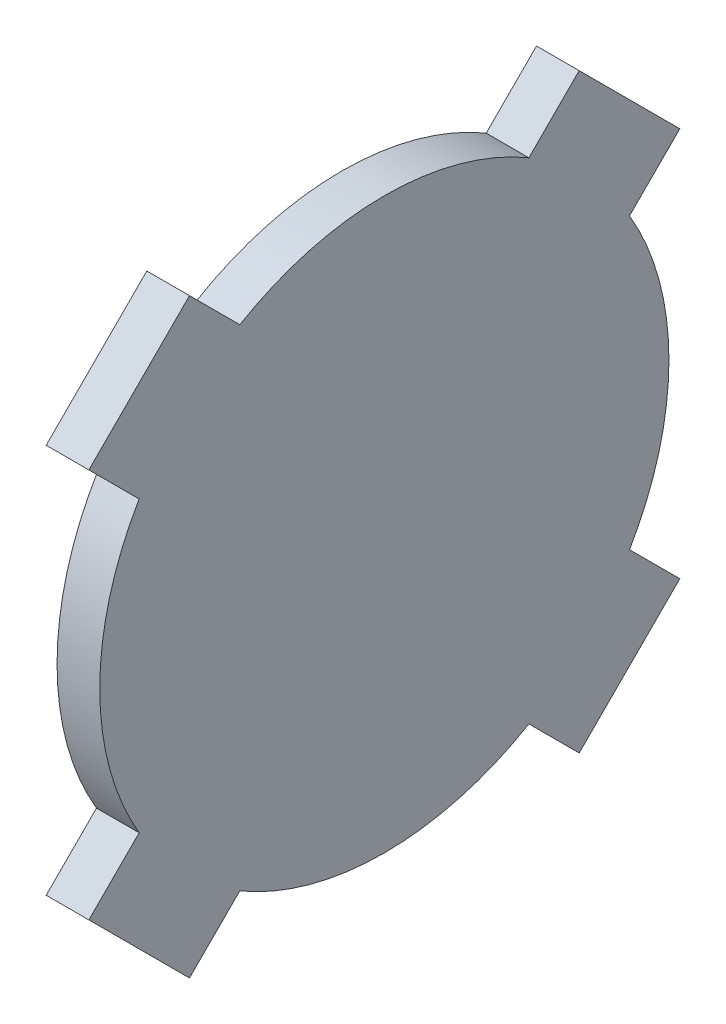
SolidWorks part; units mm, degrees
ref_plane "Front Plane" through (0, 0, 0) normal (0, 0, 1) x (1, 0, 0)
ref_plane "Top Plane" through (0, 0, 0) normal (0, 1, 0) x (1, 0, 0)
ref_plane "Right Plane" through (0, 0, 0) normal (1, 0, 0) x (0, 0, -1)
sketch "Sketch1" plane through (0, 0, 0) normal (1, 0, 0) x (0, 0, -1)
  line L3 (71.9525, -30.5373) -> (64.8814, -37.6083)
  line L4 (64.8814, 3.9199) -> (71.9525, -3.1511)
  line L5 (37.4953, -37.6083) -> (30.4242, -30.5373)
  line L6 (37.4953, -37.6083) -> (41.0308, -34.0728)
  line L7 (64.8814, 3.9199) -> (61.3459, 0.3844)
  line L8 (33.9597, -27.0017) -> (30.4242, -30.5373)
  line L9 (68.4169, -6.6867) -> (71.9525, -3.1511)
  line L10 (30.4242, -3.1511) -> (37.4953, 3.9199)
  line L11 (30.4242, -3.1511) -> (33.9597, -6.6867)
  line L12 (71.9525, -30.5373) -> (68.4169, -27.0017)
  line L13 (41.0308, 0.3844) -> (37.4953, 3.9199)
  line L14 (61.3459, -34.0728) -> (64.8814, -37.6083)
  arc A1 (33.9597, -6.6867) -> (33.9597, -27.0017) centre (51.1883, -16.8442) ccw
  arc A2 (41.0308, -34.0728) -> (61.3459, -34.0728) centre (51.1883, -16.8442) ccw
  arc A3 (61.3459, 0.3844) -> (41.0308, 0.3844) centre (51.1883, -16.8442) ccw
  arc A4 (68.4169, -27.0017) -> (68.4169, -6.6867) centre (51.1883, -16.8442) ccw
extrude "Boss-Extrude1" add sketch "Sketch1" along normal blind 3
